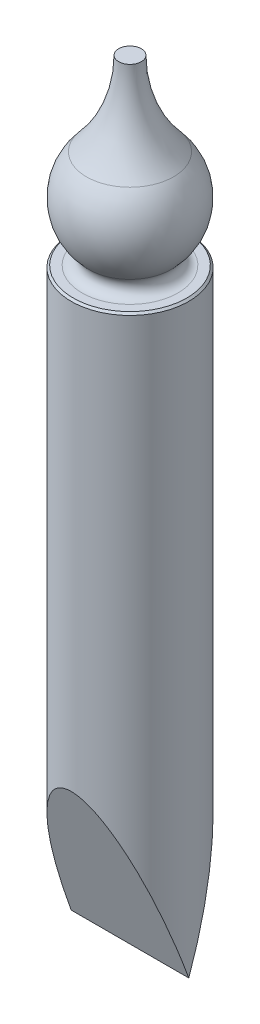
SolidWorks part; units mm, degrees
ref_plane "Спереди" through (0, 0, 0) normal (0, 0, 1) x (1, 0, 0)
ref_plane "Сверху" through (0, 0, 0) normal (0, 1, 0) x (1, 0, 0)
ref_plane "Справа" through (0, 0, 0) normal (1, 0, 0) x (0, 0, -1)
sketch "Эскиз1" plane through (0, 0, 0) normal (0, 0, 1) x (1, 0, 0)
  line L0 (-3, 0) -> (0, 0)
  line L1 (-3, 0) -> (-3, 30)
  line L2 (0, 0) -> (0, 39.2823)
  line L3 (-0.575, 39.2823) -> (0, 39.2823)
  line L4 (-3, 30) -> (-2.4495, 30)
  arc A0 (-2.2219, 35.0157) -> (-2.0996, 30.8571) centre (0, 33) ccw
  arc A1 (-2.2219, 35.0157) -> (-0.575, 39.2823) centre (-6.925, 39.2823) ccw
  arc A2 (-2.4495, 30) -> (-2.0996, 30.8571) centre (-2.4495, 30.5) ccw
  dimension "D3" = 12.7
  dimension "D6" = 1
  dimension "D2" = 3
  dimension "D4" = 0.575
  dimension "D5" = 30
revolve "Повернуть1" add sketch "Эскиз1" angle 360 about L2
sketch "Эскиз3" plane through (0, 0, 0) normal (1, 0, 0) x (0, 0, -1)
  line L0 (0, 0) -> (-3, 8.2424)
  line L1 (-3, 30) -> (-3, 0) construction
  line L2 (0, 0) -> (3, 8.2424)
  line L3 (3, 0) -> (3, 30) construction
  line L4 (3, 8.2424) -> (3, -1.1647)
  line L5 (3, -1.1647) -> (-3, -1.1647)
  line L6 (-3, -1.1647) -> (-3, 8.2424)
  dimension "D1" = 40
extrude "Вырез-Вытянуть1" cut sketch "Эскиз3" against normal mid plane 10
chamfer "Фаска1" distance 0.1 angle 45 1 edges at (0, 30, -3)
